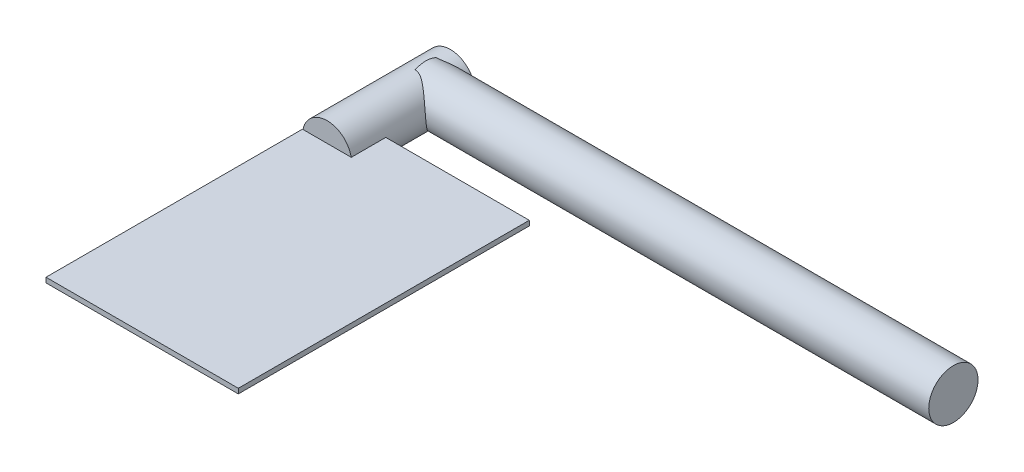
SolidWorks part; units mm, degrees
ref_plane "Front Plane" through (0, 0, 0) normal (0, 0, 1) x (1, 0, 0)
ref_plane "Top Plane" through (0, 0, 0) normal (0, 1, 0) x (1, 0, 0)
ref_plane "Right Plane" through (0, 0, 0) normal (1, 0, 0) x (0, 0, -1)
sketch "Sketch1" plane through (0, 0, 0) normal (0, 1, 0) x (1, 0, 0)
  line L1 (0, 0) -> (39, 0)
  line L2 (0, 0) -> (0, 59)
  line L3 (0, 59) -> (39, 59)
  line L4 (39, 0) -> (39, 59)
  dimension "D1" = 39
  dimension "D2" = 59
extrude "Boss-Extrude1" add sketch "Sketch1" along normal blind 1
ref_plane "Plane1" through (0, 0, -52) normal (0, 0, -1) x (-1, 0, 0)
sketch "Sketch5" plane through (0, 0, -52) normal (0, 0, -1) x (-1, 0, 0)
  line L0 (0, 0) -> (-10, 0)
  point P0 (0, 0)
  point P3 (-5, 0)
  dimension "D1" = 10
sketch "Sketch6" plane through (0, 0, -52) normal (0, 0, -1) x (-1, 0, 0)
  circle A0 centre (-5, 0) radius 5
extrude "Boss-Extrude2" add sketch "Sketch6" along normal blind 25
ref_plane "Plane2" through (5, 0, 0) normal (-1, 0, 0) x (0, 0, 1)
sketch "Sketch7" plane through (5, 0, 0) normal (-1, 0, 0) x (0, 0, 1)
  line L0 (-77, 0.4819) -> (-67, 0.4819)
  line L2 (-77, 5) -> (-77, -5) construction
  point P0 (-64.9219, 0.4819)
  point P3 (-72, 0.4819)
  dimension "D1" = 10
  dimension "D2" = 0
sketch "Sketch8" plane through (5, 0, 0) normal (-1, 0, 0) x (0, 0, 1)
  circle A0 centre (-72, 0.4819) radius 5
extrude "Boss-Extrude3" add sketch "Sketch8" against normal blind 107
